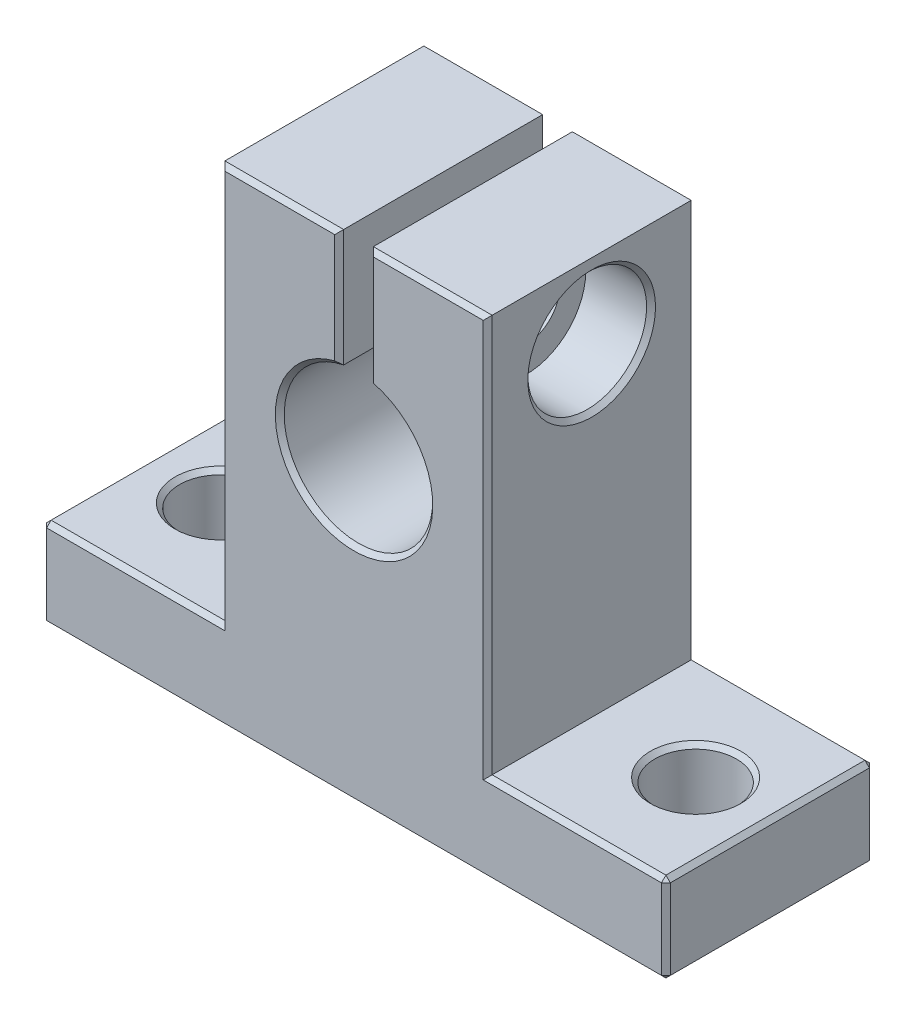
SolidWorks part; units mm, degrees
ref_plane "Front Plane" through (0, 0, 0) normal (0, 0, 1) x (1, 0, 0)
ref_plane "Top Plane" through (0, 0, 0) normal (0, 1, 0) x (1, 0, 0)
ref_plane "Right Plane" through (0, 0, 0) normal (1, 0, 0) x (0, 0, -1)
sketch "Sketch1" plane through (0, 0, 0) normal (0, 0, 1) x (1, 0, 0)
  line L0 (0, 0) -> (0, 27.7388) construction
  line L1 (21, 0) -> (-21, 0)
  line L2 (-21, 0) -> (-21, 6)
  line L3 (-21, 6) -> (-9, 6)
  line L4 (-9, 6) -> (-9, 32.8)
  line L5 (-9, 32.8) -> (9, 32.8)
  line L6 (9, 6) -> (9, 32.8)
  line L7 (21, 6) -> (9, 6)
  line L8 (21, 0) -> (21, 6)
  circle A0 centre (0, 20) radius 5
  point P9 (0, 32.8)
  dimension "D5" = 10
  dimension "D1" = 21
  dimension "D2" = 6
  dimension "D3" = 32.8
  dimension "D4" = 9
  dimension "D6" = 20
extrude "Boss-Extrude2" add sketch "Sketch1" along normal mid plane 14 contours L0 A0 | A0 L0 | L3 L4 L5 L6 L7 L8 L1 L2
sketch "Sketch2" plane through (0, 0, 7) normal (0, 0, 1) x (1, 0, 0)
  line L0 (0, 0) -> (0, 37.3013) construction
  line L1 (-9, 32.8) -> (9, 32.8) construction
  line L2 (-1, 32.8) -> (1, 32.8)
  line L3 (-1, 32.8) -> (-1, 22.9776)
  line L4 (-1, 22.9776) -> (1, 22.9776)
  line L5 (1, 32.8) -> (1, 22.9776)
  dimension "D1" = 2
extrude "Cut-Extrude1" cut sketch "Sketch2" against normal up to next contours L4 L5 L2 L3
sketch "Sketch3" plane through (0, 6, 0) normal (0, 1, 0) x (1, 0, 0)
  line L0 (-21, -7) -> (-21, 7) construction
  line L1 (21, -7) -> (21, 7) construction
  point P0 (-16, 0)
  point P5 (16, 0)
  dimension "D1" = 5
  dimension "D2" = 5
hole_wizard "Hole2" positions "3DSketch2" profile "Sketch5" legacy
sketch3d "3DSketch2"
  point P0 (-16, 6, 0)
  point P3 (16, 6, 0)
sketch "Sketch5" plane through (-16, 6, 0) normal (1, 0, 0) x (0, 0, 1)
  line L0 (0, 0) -> (0, 6)
  line L1 (0, 6) -> (2.75, 6)
  line L2 (2.75, 6) -> (2.75, 0)
  line L3 (2.75, 0) -> (0, 0)
  line L4 (0, 110) -> (0, -10) construction
  dimension "Diameter" = 5.5
  dimension "Depth" = 6
sketch "Sketch6" plane through (9, 0, 0) normal (1, 0, 0) x (0, 0, -1)
  line L0 (-7, 32.8) -> (7, 32.8) construction
  point P0 (0, 27.8)
  dimension "D1" = 5
hole_wizard "CBORE for M4 Hex Socket Head Cap Screw1" positions "3DSketch3" profile "Sketch8" counterbore size "M4" standard "ISO"
sketch3d "3DSketch3"
  point P0 (9, 27.8, 0)
sketch "Sketch8" plane through (9, 27.8, 0) normal (0, 1, 0) x (0, 0, -1)
  line L0 (0, 0) -> (0, 30)
  line L1 (0, 30) -> (2.25, 30)
  line L3 (2.25, 30) -> (2.25, 4.4)
  line L4 (2.25, 4.4) -> (4, 4.4)
  line L5 (4, 4.4) -> (4, 0)
  line L7 (4, 0) -> (0, 0)
  line L11 (0, -6.35) -> (0, 107.95) construction
  dimension "Thru Hole Dia." = 4.5
  dimension "Thru Hole Depth" = 30
  dimension "C'Bore Dia." = 8
  dimension "C'Bore Depth" = 4.4
chamfer "Chamfer1" distance 0.3 angle 45 4 edges at (9, 27.8, -4) (-16, 6, 2.75) (16, 6, 2.75) (-9, 27.8, 2.25)
chamfer "Chamfer2" distance 0.3 angle 45 28 edges at (-5, 32.8, -7) (-9, 19.4, -7) (-15, 6, -7) (-21, 3, -7) (0, 0, -7) (21, 3, -7) (15, 6, -7) (9, 19.4, -7) (5, 32.8, -7) (1, 28.8495, -7) (0, 15, -7) (-1, 28.8495, -7) (1, 28.8495, 7) (5, 32.8, 7) (9, 19.4, 7) (15, 6, 7) (21, 3, 7) (0, 0, 7) (-21, 3, 7) (-15, 6, 7) (-9, 19.4, 7) (-5, 32.8, 7) (-1, 28.8495, 7) (0, 15, 7) (-21, 6, 0) (-21, 0, 0) (21, 0, 0) (21, 6, 0)
